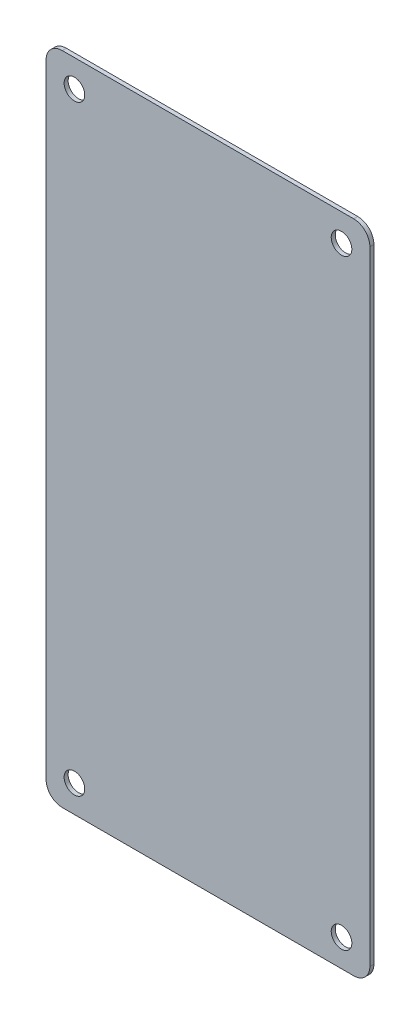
SolidWorks part; units mm, degrees
ref_plane "Front Plane" through (0, 0, 0) normal (0, 0, 1) x (1, 0, 0)
ref_plane "Top Plane" through (0, 0, 0) normal (0, 1, 0) x (1, 0, 0)
ref_plane "Right Plane" through (0, 0, 0) normal (1, 0, 0) x (0, 0, -1)
sketch "Sketch1" plane through (0, 0, 0) normal (0, 0, 1) x (1, 0, 0)
  line L1 (-40, -81) -> (40, -81)
  line L2 (-40, -81) -> (-40, 81)
  line L3 (-40, 81) -> (40, 81)
  line L4 (40, -81) -> (40, 81)
  line L5 (-40, -81) -> (40, 81) construction
  line L6 (-40, 81) -> (40, -81) construction
  point P0 (0, 0)
extrude "Boss-Extrude1" add sketch "Sketch1" along normal blind 1
fillet "Fillet1" radius 4 4 edges at (-40, 81, 0.5) (-40, -81, 0.5) (40, -81, 0.5) (40, 81, 0.5)
sketch "Sketch2" plane through (0, 0, 0) normal (0, 0, -1) x (-1, 0, 0)
  circle A0 centre (-33, -74.25) radius 2.55
  circle A3 centre (-33, 74.25) radius 2.55
  circle A4 centre (33, 74.25) radius 2.55
  circle A5 centre (33, -74.25) radius 2.55
  dimension "D1" = 5.1
extrude "Cut-Extrude1" cut sketch "Sketch2" against normal through all
equation "\"Base-Width\"= 420"
equation "\"Base-Height\"= 320"
equation "\"Support-Rod-Diameter\"= 16"
equation "\"Support-Rod-X-Offset\"= 35"
equation "\"Support-Rod-Y-Offset\"= 35"
equation "\"Base-Thickness\"= 5"
equation "\"Base-Depth\"= 82"
equation "\"Corner-Radius-Major\"= \"Support-Rod-Diameter\""
equation "\"Cutout-Horizontal\"= \"Base-Width\" * 0.8"
equation "\"Cutout-Vertical\"= \"Base-Height\" * 0.6"
equation "\"Outer-Support-Bore-Diameter\"= 6.1"
equation "\"Inner-Support-Bore-Diameter\"= 8.2"
equation "\"Cutout-Depth\"= 20"
equation "\"D1@Sketch1\"=\"Base-Depth\" - 2"
equation "\"D2@Sketch1\"=(\"Base-Width\" - (\"Support-Rod-Diameter\" * 6))/2"
equation "\"D2@Sketch1\"=\"Base-Width\""
equation "\"D1@Sketch7\"=\"Cutout-Vertical\""
equation "\"D2@Sketch6\"=\"Cutout-Horizontal\""
equation "\"D2@Sketch8\"= \"Base-Width\" - ( \"Support-Rod-X-Offset\" ) + 5"
equation "\"D1@Sketch8\" = \"Base-Height\" - \"Support-Rod-Y-Offset\" + 10"
equation "\"D1@Major-Fillet\" = \"Corner-Radius-Major\""
equation "\"D1@Sketch1\"=\"Base-Height\""
